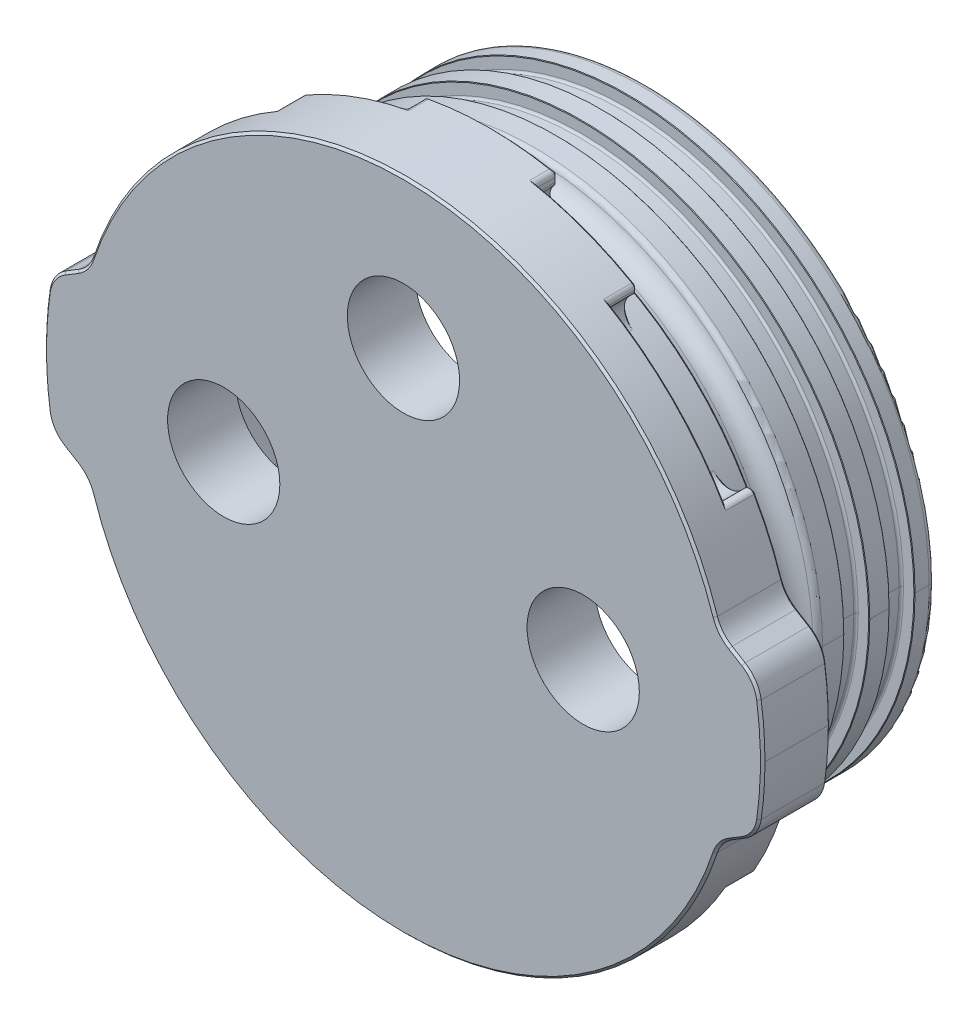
SolidWorks part; units mm, degrees
other "Flange Cap Cutout Chamfer[1]"
ref_plane "Front Plane" through (0, 0, 0) normal (0, 0, 1) x (1, 0, 0)
ref_plane "Top Plane" through (0, 0, 0) normal (0, 1, 0) x (1, 0, 0)
ref_plane "Right Plane" through (0, 0, 0) normal (1, 0, 0) x (0, 0, -1)
imported_body "Imported1"
sketch "Sketch1" plane through (0, 0, 21.5) normal (0, 0, 1) x (1, 0, 0)
  line L5 (-5.3043, -3.0008) -> (-7.9961, 7.6633) construction
  line L6 (-7.9961, 7.6633) -> (-18.5774, 10.664) construction
  line L7 (-18.5774, 10.664) -> (-26.4668, 3.0008) construction
  line L8 (-26.4668, 3.0008) -> (-23.7749, -7.6633) construction
  line L9 (-23.7749, -7.6633) -> (-13.1936, -10.664) construction
  line L10 (-13.1936, -10.664) -> (-5.3043, -3.0008) construction
  line L11 (0, 0) -> (-15.8855, 0) construction
  line L13 (0, 0) -> (0, 15.8855) construction
  line L15 (0, 0) -> (15.8855, 0) construction
  circle A0 centre (0, 0) radius 15.8855 construction
  circle A1 centre (-15.8855, 0) radius 5.5562
  circle A2 centre (0, 15.8855) radius 5.5562
  circle A3 centre (15.8855, 0) radius 5.5562
  circle A5 centre (0, 15.8855) radius 11.0802 construction
  circle A6 centre (15.8855, 0) radius 11.0802 construction
  circle A8 centre (-15.8855, 0) radius 11.0802 construction
  circle A9 centre (-15.8855, 0) radius 9.525 construction
  point P3 (15.8855, 0)
  point P5 (0, 15.8855)
  point P6 (-15.8855, 0)
  dimension "D2" = 11.1125
  dimension "D1" = 19.05
hole_wizard "7/16-20 Tapped Hole1" positions "Sketch1" profile "Sketch3" tap size "7/16-20" standard "ANSI Inch"
sketch "Sketch3" plane through (-15.8855, 0, 21.5) normal (1, 0, 0) x (0, -1, 0)
  line L0 (0, 0) -> (0, 21.5)
  line L1 (0, 21.5) -> (4.9606, 21.5)
  line L2 (4.9606, 21.5) -> (4.9606, 0)
  line L5 (4.9606, 0) -> (0, 0)
  line L11 (0, -6.35) -> (0, 107.95) construction
  dimension "Thru Tap Drill Dia." = 9.9212
  dimension "Thru Tap Drill Depth" = 21.5
